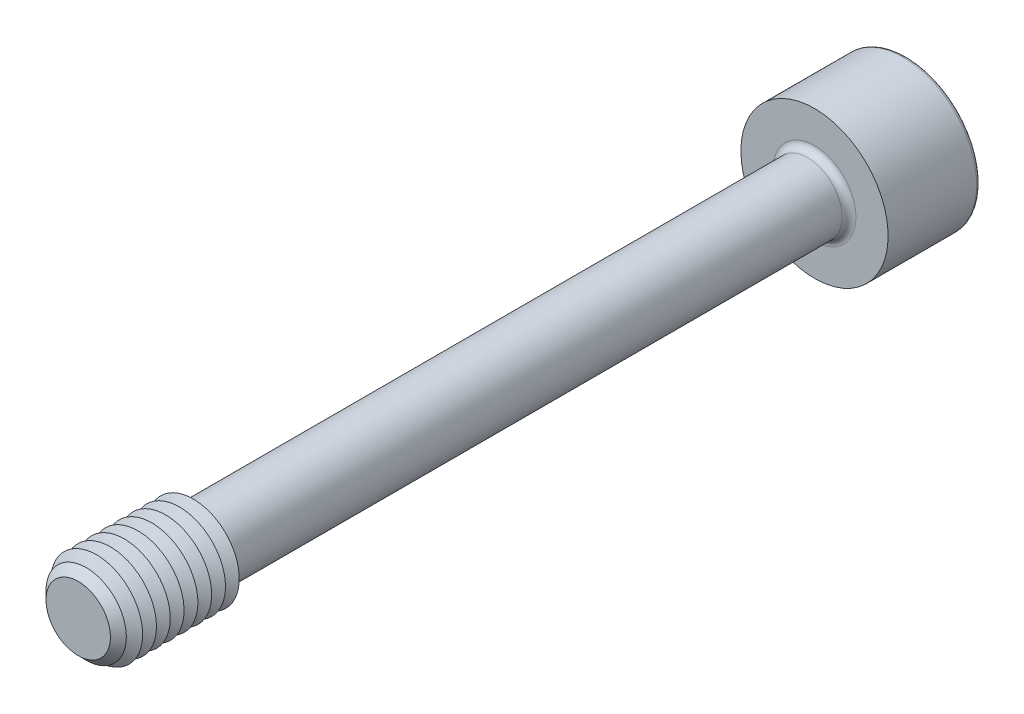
SolidWorks part; units mm, degrees
ref_plane "Front Plane" through (0, 0, 0) normal (0, 0, 1) x (1, 0, 0)
ref_plane "Top Plane" through (0, 0, 0) normal (0, 1, 0) x (1, 0, 0)
ref_plane "Right Plane" through (0, 0, 0) normal (1, 0, 0) x (0, 0, -1)
sketch "Sketch1" plane through (0, 0, 0) normal (0, 0, 1) x (1, 0, 0)
  circle A0 centre (0, 0) radius 3.75
  dimension "D1" = 7.5
extrude "Extrude1" add sketch "Sketch1" along normal mid plane 80
sketch "Sketch2" plane through (0, 0, 0) normal (1, 0, 0) x (0, 0, -1)
  line L0 (-40, 0) -> (-40, 5)
  line L1 (-40, 3.75) -> (-40, -3.75) construction
  line L2 (-40, 5) -> (-27.5, 5)
  line L3 (-27.5, 5) -> (-26.7783, 3.75)
  line L4 (40, 3.75) -> (-40, 3.75) construction
  line L5 (-26.7783, 3.75) -> (-26.7783, 0)
  line L6 (-26.7783, 0) -> (-40, 0)
  dimension "D1" = 5
  dimension "D2" = 120
  dimension "D3" = 12.5
revolve "Revolve1" add sketch "Sketch2" angle 360 about L6
chamfer "Chamfer1" distance 1.5 angle 45 1 edges at (0, 5, 40)
sketch "Sketch3" plane through (0, 0, -40) normal (0, 0, -1) x (-1, 0, 0)
  circle A0 centre (0, 0) radius 8
  dimension "D1" = 16
extrude "Extrude2" add sketch "Sketch3" along normal blind 10
sketch "Sketch4" plane through (-13.7, 0, -50) normal (0, 0, 1) x (1, 0, 0)
  line L2 (11.3906, -4) -> (16.0094, -4)
  line L3 (16.0094, -4) -> (18.3188, 0)
  line L4 (18.3188, 0) -> (16.0094, 4)
  line L6 (16.0094, 4) -> (11.3906, 4)
  line L7 (11.3906, 4) -> (9.0812, 0)
  line L8 (9.0812, 0) -> (11.3906, -4)
  circle A0 centre (13.7, 0) radius 4 construction
  dimension "D1" = 8
extrude "Extrude3" cut sketch "Sketch4" along normal blind 8
fillet "Fillet1" radius 0.75 1 edges at (-3.75, 0, -40)
fillet "Fillet2" radius 0.375 1 edges at (-8, 0, -50)
sketch "Sketch5" plane through (0, 0, 0) normal (1, 0, 0) x (0, 0, -1)
  line L0 (42, 0) -> (42, -4)
  line L1 (42, -4) -> (39.6906, 0)
  line L2 (39.6906, 0) -> (42, 0)
  dimension "D1" = 30
revolve "Cut-Revolve1" cut sketch "Sketch5" angle 360 about L2
sketch "Sketch6" plane through (0, 0, 0) normal (1, 0, 0) x (0, 0, -1)
  line L0 (1.332, 0) -> (-13.289, 0) construction
sketch "Sketch7" plane through (0, 0, 0) normal (1, 0, 0) x (0, 0, -1)
  line L0 (-27.5, 5) -> (-28.25, 3.701)
  line L1 (-28.25, 3.701) -> (-29, 5)
  line L2 (-27.5, 5) -> (-38.5, 5) construction
  line L3 (-29, 5) -> (-27.5, 5)
  dimension "D1" = 1.5
revolve "Cut-Revolve2" cut sketch "Sketch7" angle 360 about L0
pattern_linear "LPattern1" count 8 spacing 1.5 along (0, 0, 1) of "Cut-Revolve2"
